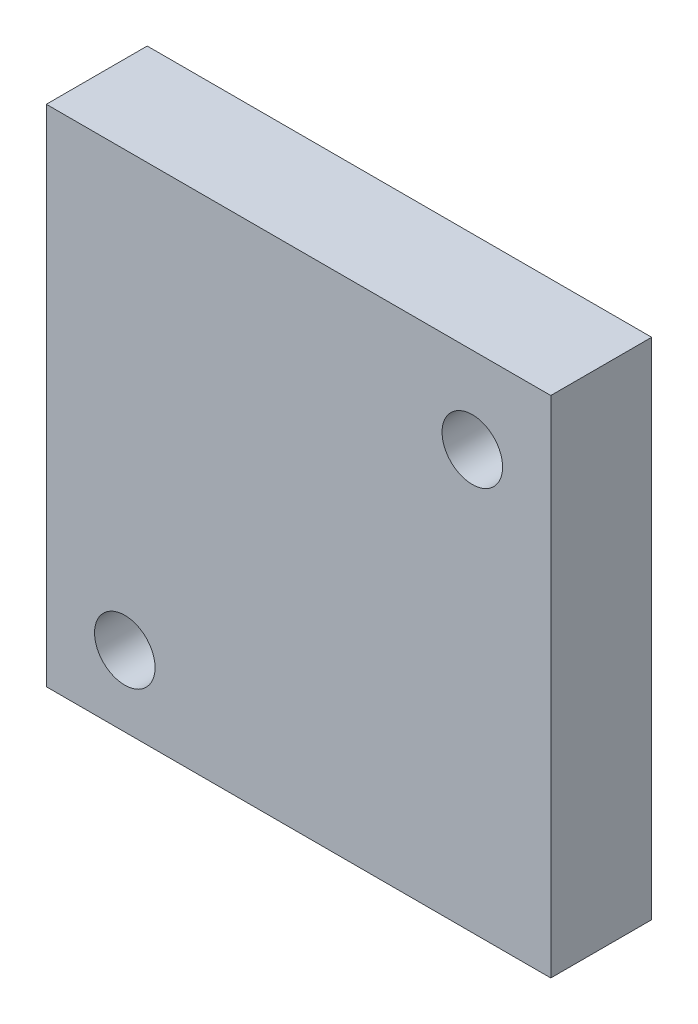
SolidWorks part; units mm, degrees
ref_plane "Front Plane" through (0, 0, 0) normal (0, 0, 1) x (1, 0, 0)
ref_plane "Top Plane" through (0, 0, 0) normal (0, 1, 0) x (1, 0, 0)
ref_plane "Right Plane" through (0, 0, 0) normal (1, 0, 0) x (0, 0, -1)
sketch "Sketch1" plane through (0, 0, 0) normal (0, 0, 1) x (1, 0, 0)
  line L1 (-50, 50) -> (50, 50)
  line L2 (-50, 50) -> (-50, -50)
  line L3 (-50, -50) -> (50, -50)
  line L4 (50, 50) -> (50, -50)
  dimension "D1" = 100
  dimension "D2" = 100
  dimension "D3" = 50
  dimension "D4" = 50
extrude "Extrude1" add sketch "Sketch1" along normal blind 20
hole_wizard "Ø12.0 (12) Diameter Hole1" positions "3DSketch2" profile "Sketch3" hole size "Ø12.0" standard "ISO"
sketch3d "3DSketch2"
  point P0 (-34.4451, -35.9477, 20)
  point P2 (34.4451, 32.9424, 20)
sketch "Sketch3" plane through (-34.4451, -35.9477, 20) normal (1, 0, 0) x (0, -1, 0)
  line L0 (0, 0) -> (0, 20)
  line L1 (0, 20) -> (6, 20)
  line L2 (6, 20) -> (6, 0)
  line L5 (6, 0) -> (0, 0)
  line L11 (0, -6.35) -> (0, 107.95) construction
  dimension "Thru Hole Dia." = 12
  dimension "Thru Hole Depth" = 20
